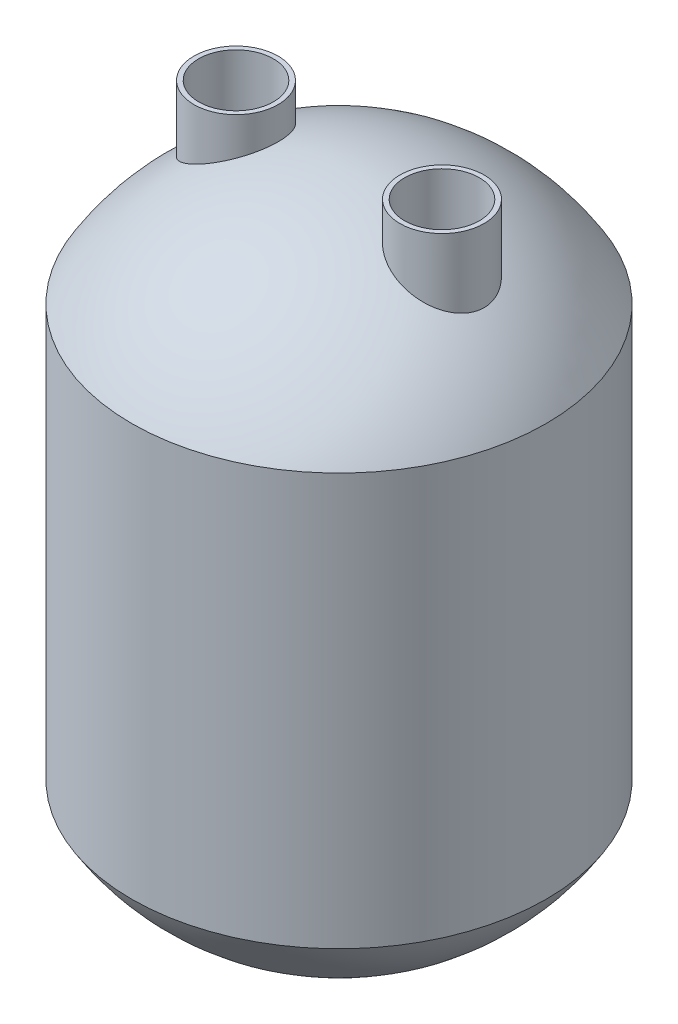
SolidWorks part; units mm, degrees
ref_plane "Alzado" through (0, 0, 0) normal (0, 0, 1) x (1, 0, 0)
ref_plane "Planta" through (0, 0, 0) normal (0, 1, 0) x (1, 0, 0)
ref_plane "Vista lateral" through (0, 0, 0) normal (1, 0, 0) x (0, 0, -1)
sketch "Croquis1" plane through (0, 0, 0) normal (0, 0, 1) x (1, 0, 0)
  line L0 (0, 161.6999) -> (0, 157.6999)
  line L1 (70.4273, 121.6999) -> (70.4273, -18.3001)
  line L2 (0, -58.3001) -> (0, -54.3001)
  line L3 (66.4273, -17.1831) -> (66.4273, 120.5829)
  line L4 (0, 161.6999) -> (0, -58.3001) construction
  arc A0 (0, 161.6999) -> (70.4273, 121.6999) centre (0, 79.6999) cw
  arc A1 (0, -58.3001) -> (70.4273, -18.3001) centre (0, 23.6999) ccw
  arc A2 (0, -54.3001) -> (66.4273, -17.1831) centre (0, 23.6999) ccw
  arc A3 (0, 157.6999) -> (66.4273, 120.5829) centre (0, 79.6999) cw
  dimension "D6" = 82
  dimension "D7" = 82
  dimension "D8" = 78
  dimension "D9" = 78
  dimension "D1" = 4
  dimension "D2" = 40
  dimension "D3" = 40
  dimension "D4" = 220
  dimension "D5" = 4
  dimension "D10" = 4
revolve "Revolución1" add sketch "Croquis1" angle 360 about L4
ref_plane "Plano1" through (0, 140, 0) normal (0, 1, 0) x (-1, 0, 0)
sketch "Croquis2" plane through (0, 140, 0) normal (0, 1, 0) x (-1, 0, 0)
  circle A0 centre (-35, 0) radius 12.7
  circle A1 centre (35, 0) radius 12.7
  dimension "D3" = 25.4
  dimension "D4" = 25.4
  dimension "D1" = 70
  dimension "D2" = 35
extrude "Cortar-Extruir1" cut sketch "Croquis2" along normal blind 28
sketch "Croquis3" plane through (0, 140, 0) normal (0, 1, 0) x (-1, 0, 0)
  circle A0 centre (-35, 0) radius 12.7
  circle A1 centre (-35, 0) radius 14.3
  circle A2 centre (35, 0) radius 12.7
  circle A3 centre (35, 0) radius 14.3
  dimension "D1" = 28.6
  dimension "D2" = 28.6
extrude "Saliente-Extruir1" add sketch "Croquis3" along normal blind 30
ref_plane "Plano2" through (0, 0, 0) normal (0, 0, 1) x (1, 0, 0)
